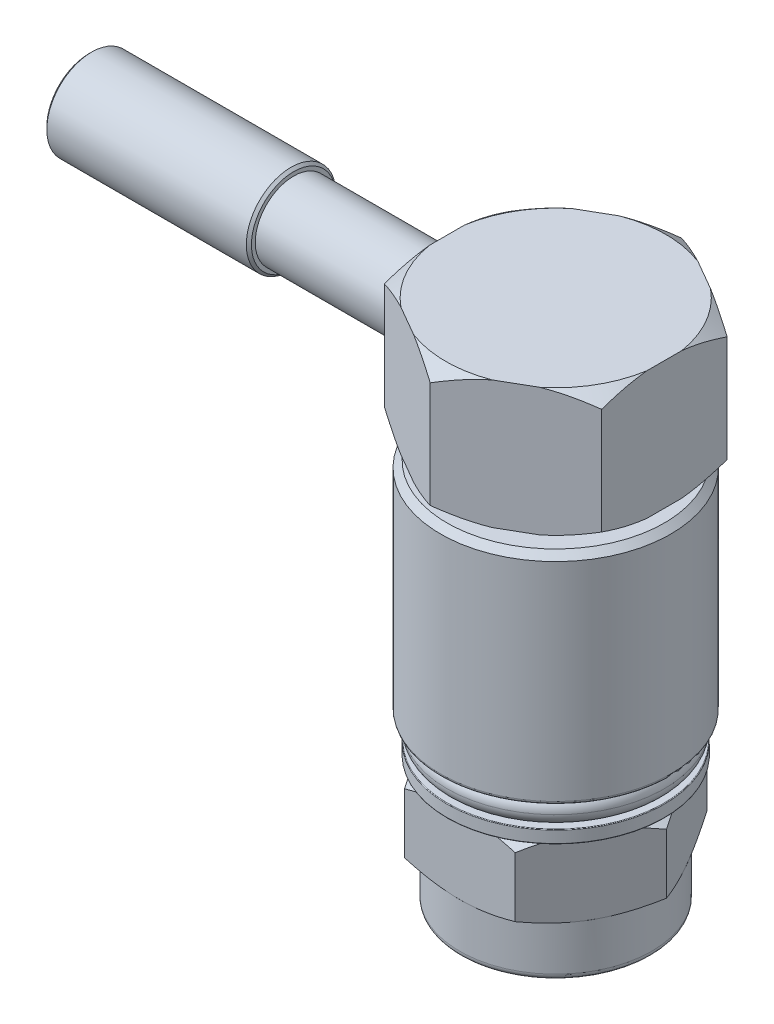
SolidWorks part; units mm, degrees
ref_plane "Front Plane" through (0, 0, 0) normal (0, 0, 1) x (1, 0, 0)
ref_plane "Top Plane" through (0, 0, 0) normal (0, 1, 0) x (1, 0, 0)
ref_plane "Right Plane" through (0, 0, 0) normal (1, 0, 0) x (0, 0, -1)
sketch "Sketch1" plane through (0, 0, 0) normal (0, 1, 0) x (1, 0, 0)
  line L1 (0, 9.815) -> (-8.5, 4.9075)
  line L2 (-8.5, 4.9075) -> (-8.5, -4.9075)
  line L3 (-8.5, -4.9075) -> (0, -9.815)
  line L4 (0, -9.815) -> (8.5, -4.9075)
  line L5 (8.5, -4.9075) -> (8.5, 4.9075)
  line L6 (8.5, 4.9075) -> (0, 9.815)
  circle A0 centre (0, 0) radius 8.5 construction
  dimension "D1" = 17
extrude "Boss-Extrude1" add sketch "Sketch1" along normal blind 10
sketch "Sketch3" plane through (0, 0, 0) normal (1, 0, 0) x (0, 0, -1)
  line L0 (-9.915, 9.0847) -> (-8.465, 10.1)
  line L1 (-8.465, 10.1) -> (-9.915, 10.1)
  line L2 (-9.915, 9.0847) -> (-9.915, 10.1)
  line L3 (-9.815, 10) -> (-4.9075, 10) construction
  line L4 (-9.815, 10) -> (-9.815, 0) construction
  line L5 (-9.815, 5) -> (9.815, 5) construction
  line L6 (9.815, 10) -> (9.815, 0) construction
  line L7 (0, 10) -> (0, 0) construction
  line L8 (-4.9075, 10) -> (4.9075, 10) construction
  line L9 (-9.915, 0.9153) -> (-9.915, -0.1)
  line L10 (-8.465, -0.1) -> (-9.915, -0.1)
  line L11 (-9.915, 0.9153) -> (-8.465, -0.1)
  dimension "D1" = 0.1
  dimension "D2" = 0.1
  dimension "D3" = 35
  dimension "D4" = 1.45
revolve "Cut-Revolve2" cut sketch "Sketch3" angle 360 about L7
sketch "Sketch4" plane through (0, 0, 0) normal (0, -1, 0) x (1, 0, 0)
  circle A0 centre (0, 0) radius 5.5
  dimension "D1" = 11
extrude "Boss-Extrude2" add sketch "Sketch4" along normal blind 10
ref_plane "Plane1" through (0, -1, 0) normal (0, -1, 0) x (1, 0, 0)
sketch "Sketch5" plane through (0, -1, 0) normal (0, -1, 0) x (1, 0, 0)
  circle A0 centre (0, 0) radius 9
  dimension "D1" = 18
extrude "Boss-Extrude3" add sketch "Sketch5" along normal blind 17
chamfer "Chamfer1" distance 0.5 angle 45 1 edges at (0, -1, -9)
sketch "Sketch8" plane through (0, 0, 0) normal (0, 0, 1) x (1, 0, 0)
  line L0 (-8.5, 5) -> (-36.4, 5) construction
  line L1 (-8.5, 9.1547) -> (-8.5, 0.8453) construction
  line L2 (-36.3, 8.5) -> (-36.5, 8.3)
  line L3 (-8.5, 8) -> (-20.5, 8)
  line L4 (-20.5, 8) -> (-20.5, 8.3)
  line L5 (-20.7, 8.5) -> (-36.3, 8.5)
  line L6 (-36.5, 8.3) -> (-36.5, 7.5)
  line L7 (-36.5, 7.5) -> (-36.4, 7.5)
  line L8 (-36.4, 7.5) -> (-36.4, 5)
  line L9 (-20.5, 8.3) -> (-20.7, 8.5)
  line L10 (-8.5, 8) -> (-8.5, 5)
  line L11 (-8.5, 5) -> (-36.4, 5)
  point P6 (-36.5, 8.5)
  point P7 (-20.5, 8.5)
  dimension "D1" = 0.1
  dimension "D2" = 2.5
  dimension "D3" = 3.5
  dimension "D4" = 12
  dimension "D5" = 16
  dimension "D6" = 3
revolve "Revolve1" add sketch "Sketch8" angle 360 about L11
fillet "Fillet1" radius 0.25 1 edges at (0, -18, -9)
sketch "Sketch9" plane through (0, 0, 0) normal (1, 0, 0) x (0, 0, -1)
  line L0 (0, -18) -> (0, -25.404) construction
  line L1 (-8.75, -18) -> (8.75, -18) construction
  line L2 (0, -18) -> (-7.501, -18)
  line L3 (-8.5, -18.999) -> (-8.5, -19.001)
  line L4 (0, -18) -> (0, -21)
  line L5 (-7.501, -20) -> (-8.45, -20)
  line L6 (-8.5, -20.05) -> (-8.5, -20.95)
  line L7 (-8.45, -21) -> (0, -21)
  arc A0 (-8.5, -19.001) -> (-7.501, -20) centre (-7.501, -19.001) ccw
  arc A1 (-7.501, -18) -> (-8.5, -18.999) centre (-7.501, -18.999) ccw
  arc A2 (-8.5, -20.05) -> (-8.45, -20) centre (-8.45, -20.05) cw
  arc A3 (-8.5, -20.95) -> (-8.45, -21) centre (-8.45, -20.95) ccw
  point P10 (-8.5, -20)
  point P13 (-8.5, -18)
  point P19 (-8.5, -20)
  point P22 (-8.5, -21)
  dimension "D3" = 0.999
  dimension "D6" = 0.05
  dimension "D1" = 17
  dimension "D2" = 2
  dimension "D4" = 1
  dimension "D5" = 17
  dimension "D7" = 2
revolve "Revolve2" add sketch "Sketch9" angle 360 about L0
sketch "Sketch10" plane through (0, -21, 0) normal (0, -1, 0) x (1, 0, 0)
  line L1 (8.6603, 0) -> (4.3301, 7.5)
  line L2 (4.3301, 7.5) -> (-4.3301, 7.5)
  line L3 (-4.3301, 7.5) -> (-8.6603, 0)
  line L4 (-8.6603, 0) -> (-4.3301, -7.5)
  line L5 (-4.3301, -7.5) -> (4.3301, -7.5)
  line L6 (4.3301, -7.5) -> (8.6603, 0)
  circle A0 centre (0, 0) radius 7.5 construction
  dimension "D1" = 15
extrude "Boss-Extrude4" add sketch "Sketch10" along normal blind 6
sketch "Sketch11" plane through (0, 0, 0) normal (0, 0, 1) x (1, 0, 0)
  line L0 (-7.5103, -21) -> (-8.7603, -21)
  line L1 (-8.4415, -21) -> (-4.5489, -21) construction
  line L2 (-8.7603, -21) -> (-8.7603, -21.7217)
  line L3 (-8.7603, -21.7217) -> (-7.5103, -21)
  line L4 (-8.6603, -27) -> (-8.6603, -21) construction
  line L5 (-8.6603, -24) -> (8.6603, -24) construction
  line L6 (8.6603, -27) -> (8.6603, -21) construction
  line L7 (-8.7603, -26.2783) -> (-7.5103, -27)
  line L8 (-8.7603, -27) -> (-8.7603, -26.2783)
  line L9 (-7.5103, -27) -> (-8.7603, -27)
  line L10 (0, -24) -> (0, -27) construction
  line L11 (4.3301, -27) -> (-4.3301, -27) construction
  dimension "D1" = 30
  dimension "D2" = 1.25
  dimension "D3" = 0.1
revolve "Cut-Revolve3" cut sketch "Sketch11" angle 360 about L10
sketch "Sketch12" plane through (0, 0, 0) normal (0, 0, 1) x (1, 0, 0)
  line L0 (0, -27) -> (0, -31) construction
  line L1 (0.3923, -27) -> (-0.3923, -27) construction
  line L2 (-7.5103, -27) -> (-7.5103, -30.5)
  line L3 (-7.0103, -31) -> (-6.5203, -31)
  line L4 (-6.5203, -31) -> (-6.5203, -30.9)
  line L5 (-6.5203, -30.9) -> (-6.5103, -30.9)
  line L6 (-6.5103, -30.9) -> (-6.5103, -31)
  line L7 (-6.5103, -31) -> (0, -31)
  line L8 (0, -27) -> (0, -31)
  line L9 (-7.5103, -27) -> (0, -27)
  arc A0 (-7.5103, -30.5) -> (-7.0103, -31) centre (-7.0103, -30.5) ccw
  point P10 (-7.5103, -31)
  dimension "D2" = 0.5
  dimension "D1" = 4
  dimension "D3" = 0.01
  dimension "D4" = 0.1
  dimension "D5" = 1
revolve "Revolve3" add sketch "Sketch12" angle 360 about L0
